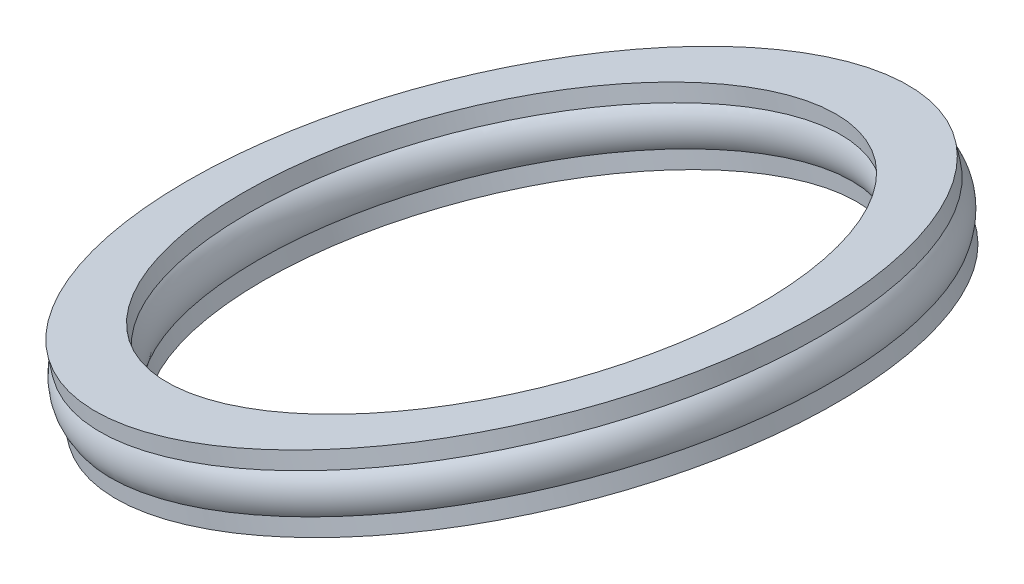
SolidWorks part; units mm, degrees
ref_plane "Alzado" through (0, 0, 0) normal (0, 0, 1) x (1, 0, 0)
ref_plane "Planta" through (0, 0, 0) normal (0, 1, 0) x (1, 0, 0)
ref_plane "Vista lateral" through (0, 0, 0) normal (1, 0, 0) x (0, 0, -1)
sketch "Sk_Jaula" plane through (0, 0, 0) normal (0, 0, 1) x (1, 0, 0)
  line L0 (380.2637, 538.3273) -> (383.5063, 539.3497)
  line L1 (383.5063, 539.3497) -> (384.7092, 535.5349)
  line L2 (384.7092, 535.5349) -> (381.4665, 534.5124)
  line L3 (381.4665, 534.5124) -> (380.2637, 538.3273)
  line L4 (363.6914, 538.3446) -> (374.2164, 504.9646) construction
revolve "Jaula" add sketch "Sk_Jaula" angle 360 about L4
sketch "Sk_Bolas" plane through (0, 0, 0) normal (0, 0, 1) x (1, 0, 0)
  line L0 (362.7893, 541.2057) -> (368.8036, 522.1314) construction
  circle A0 centre (382.4864, 536.9311) radius 2
  dimension "DIAM1" = 4
revolve "Bolas" add sketch "Sk_Bolas" angle 360 about L0
